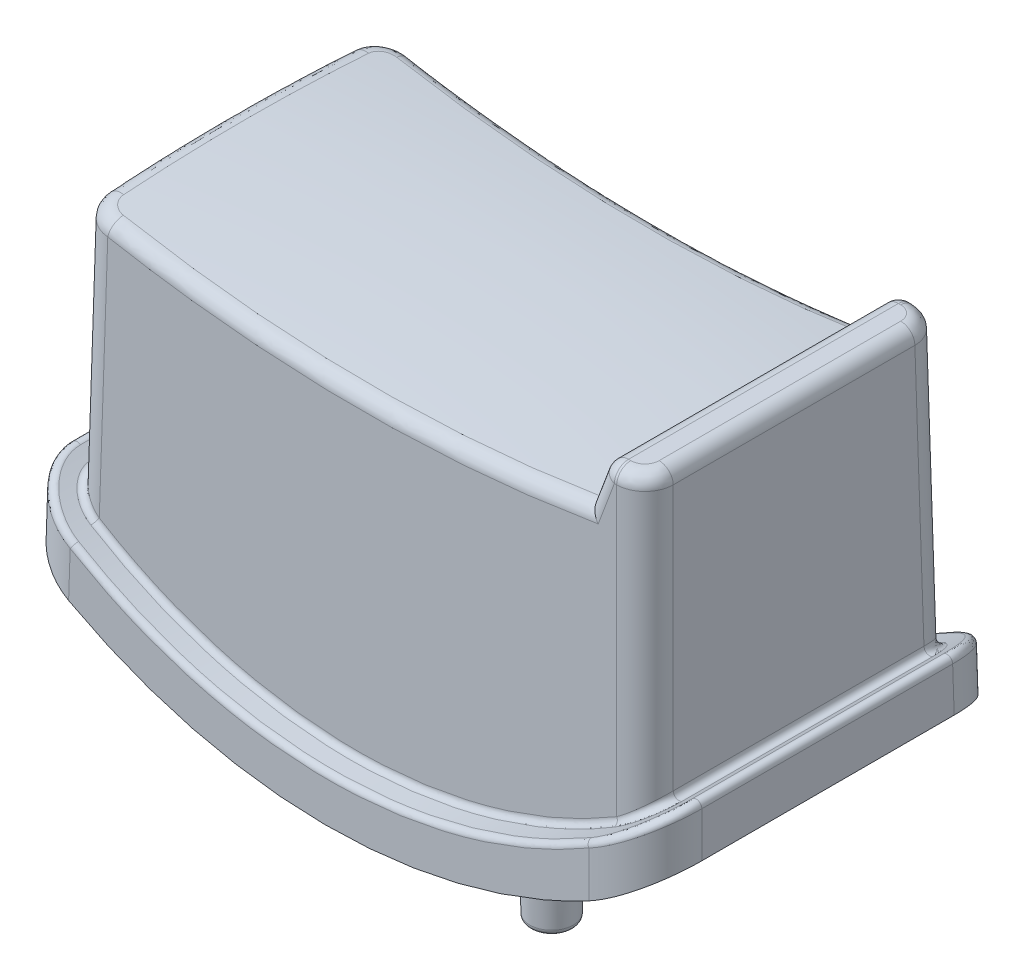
SolidWorks part; units mm, degrees
ref_plane "Front Plane" through (0, 0, 0) normal (0, 0, 1) x (1, 0, 0)
ref_plane "Top Plane" through (0, 0, 0) normal (0, 1, 0) x (1, 0, 0)
ref_plane "Right Plane" through (0, 0, 0) normal (1, 0, 0) x (0, 0, -1)
imported_body "Imported1"
other "DeleteFace1"
imported_body "Surface-Imported1"
move or copy body "Body-Move/Copy1" bodies to move or copy 103 copy no translate (0, 63.5, 0)
other "Replace Face1"
fillet "Fillet1" radius 0.635 5 edges at (-12.4038, 0.9723, -6.2287) (-12.2123, 0.9182, 6.4248)
